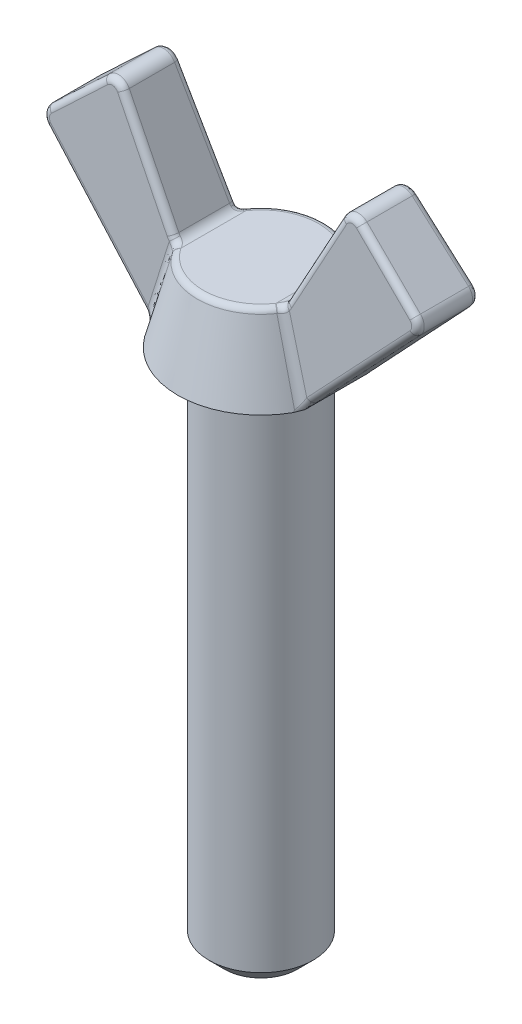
SolidWorks part; units mm, degrees
ref_plane "Front Plane" through (0, 0, 0) normal (0, 0, 1) x (1, 0, 0)
ref_plane "Top Plane" through (0, 0, 0) normal (0, 1, 0) x (1, 0, 0)
ref_plane "Right Plane" through (0, 0, 0) normal (1, 0, 0) x (0, 0, -1)
sketch "HeadSke" plane through (0, 0, 0) normal (0, 0, 1) x (1, 0, 0)
  line L0 (0, 0) -> (-8, 0)
  line L1 (-8, 0) -> (-6, 7.5)
  line L2 (-6, 7.5) -> (0, 7.5)
  line L3 (0, 7.5) -> (0, 0)
  line L4 (0, -38.5148) -> (0, 38.5148) construction
  dimension "Top_Width" = 12
  dimension "Bottom_Width" = 16
  dimension "Head_Height" = 7.5
revolve "Head" add sketch "HeadSke" angle 360 about L4
sketch "BaseWingSke" plane through (0, 0, 0) normal (1, 0, 0) x (0, 0, -1)
  line L0 (0, 0) -> (0, 62.8635) construction
  line L1 (-2.75, 18) -> (-3.25, 0)
  line L2 (-2.75, 18) -> (2.75, 18)
  line L3 (2.75, 18) -> (3.25, 0)
  line L4 (3.25, 0) -> (-3.25, 0)
  point P8 (0, 18)
  dimension "TopWing_Width" = 5.5
  dimension "BottomWing_Width" = 6.5
  dimension "Height" = 18
extrude "BaseWing" add sketch "BaseWingSke" along normal mid plane 36
sketch "CutWingSke" plane through (0, 0, 0) normal (0, 0, 1) x (1, 0, 0)
  line L0 (0, 0) -> (0, 84.5075) construction
  line L1 (-7.3101, 0) -> (-17.6742, 11.0212)
  line L2 (-5.1719, 7.5) -> (-10.4718, 17.3678)
  line L3 (18, 18) -> (-18, 18) construction
  line L4 (-18, 18) -> (-18, 0) construction
  line L5 (-5.1719, 7.5) -> (5.1719, 7.5)
  line L6 (-7.3101, 0) -> (7.3101, 0)
  line L7 (7.3101, 0) -> (17.6742, 11.0212)
  line L8 (5.1719, 7.5) -> (10.4718, 17.3678)
  line L9 (-7.3101, 0) -> (-18, 0) construction
  line L10 (-28, 28) -> (28, 28)
  line L11 (-28, 28) -> (-28, -10)
  line L12 (-28, -10) -> (28, -10)
  line L13 (28, 28) -> (28, -10)
  line L14 (18, 18) -> (18, 0) construction
  line L15 (-12.3511, 17.6742) -> (-17.6221, 12.7174)
  line L16 (12.3511, 17.6742) -> (17.6221, 12.7174)
  arc A0 (-10.4718, 17.3678) -> (-12.3511, 17.6742) centre (-11.529, 16.8) ccw
  arc A1 (-17.6742, 11.0212) -> (-17.6221, 12.7174) centre (-16.8, 11.8433) cw
  arc A2 (12.3511, 17.6742) -> (10.4718, 17.3678) centre (11.529, 16.8) ccw
  arc A3 (17.6742, 11.0212) -> (17.6221, 12.7174) centre (16.8, 11.8433) ccw
  point P27 (-11.2118, 18.7455)
  point P30 (-18.4963, 11.8954)
  point P33 (11.2118, 18.7455)
  point P36 (18.4963, 11.8954)
  dimension "Radius" = 1.2
  dimension "D1" = 10
  dimension "Wing_ang" = 15
  dimension "D2" = 10
  dimension "D3" = 10
  dimension "D4" = 10
extrude "CutWing" cut sketch "CutWingSke" against normal mid plane 36
fillet "Fillet1" radius 1 6 edges at (-5.1719, 7.5, 0) (5.1719, 7.5, 0)
fillet "Fillet2" radius 0.6 38 edges at (-7.5707, 0.2772, 3.2891) (-12.7428, 5.7771, 3.0895) (-8.0054, 12.7756, 2.8951) (-5.2567, 7.7694, 3.1144) (0, 7.5, -6) (0, 7.5, 6) (5.1125, 7.6575, 3.2115) (8.0054, 12.7756, 2.8951) (7.4702, 0.1703, 3.342) (12.7428, 5.7771, 3.0895) (7.5707, 0.2772, -3.2891) (12.7428, 5.7771, -3.0895) (-7.4702, 0.1703, -3.342) (-12.7428, 5.7771, -3.0895) (-8.0054, 12.7756, -2.8951) (-5.1125, 7.6575, -3.2115) (5.2567, 7.7694, -3.1144) (8.0054, 12.7756, -2.8951) (17.9994, 11.8801, -2.92) (14.9866, 15.1958, -2.8279) (11.3359, 17.9844, -2.7504) (-17.9994, 11.8801, -2.92) (-14.9866, 15.1958, -2.8279) (-11.3359, 17.9844, -2.7504) (17.9994, 11.8801, 2.92) (14.9866, 15.1958, 2.8279) (11.3359, 17.9844, 2.7504) (-11.3359, 17.9844, 2.7504) (-14.9866, 15.1958, 2.8279) (-17.9994, 11.8801, 2.92)
sketch "BodySke" plane through (0, 0, 0) normal (0, 0, 1) x (1, 0, 0)
  line L0 (0, 0) -> (0, -98.4281) construction
  line L1 (-4.172, -22.6535) -> (-4.172, -78.0459) construction
  line L2 (0, 0) -> (-5, 0)
  line L3 (0, 0) -> (0, -50)
  line L4 (0, -50) -> (-5, -50)
  line L5 (-5, 0) -> (-5, -50)
  line L6 (9.5285, -49.25) -> (-28.2347, -49.25) construction
  dimension "Diameter" = 10
  dimension "Length" = 50
  dimension "Minor_dia" = 8.344
  dimension "Advance" = 1.5
revolve "BaseBody" add sketch "BodySke" angle 360 about L0
sketch "ChamferedEndSke" plane through (0, 0, 0) normal (0, 0, 1) x (1, 0, 0)
  line L0 (-5, -48.5) -> (-5, -50)
  line L1 (-5, -50) -> (-3.5, -50)
  line L2 (-3.5, -50) -> (-5, -48.5)
  line L5 (0, 0) -> (0, -116.5105) construction
  dimension "Ang" = 45
  dimension "Chamfer_width" = 1.5
revolve "ChamferedEnd" cut sketch "ChamferedEndSke" angle 360 about L5
sketch "CutEndSke" plane through (0, -50, 0) normal (0, -1, 0) x (1, 0, 0)
  circle A0 centre (0, 0) radius 5 construction
  circle A1 centre (0, 0) radius 5
extrude "CutEnd" [suppressed] cut sketch "CutEndSke" against normal blind 1.5
dome "RoundedEnd" [suppressed] faces to dome 1 distance 1.5 parameters "D1"=1.5
sketch "ThdSchSke" plane through (0, 0, 0) normal (0, 0, 1) x (1, 0, 0)
  line L0 (0, 0) -> (0, -154.0819) construction
  line L1 (49.4883, -50) -> (-82.1477, -50) construction
  line L2 (5.9561, -48.247) -> (5, -48.247)
  line L3 (5, -48.247) -> (4.172, -48.725)
  line L4 (4.172, -48.725) -> (5, -49.203)
  line L5 (5, -49.203) -> (5.9561, -49.203)
  line L6 (5.9561, -49.203) -> (5.9561, -48.247)
  dimension "D1" = 8.344
  dimension "Length" = 50
  dimension "D2" = 10
  dimension "D3" = 1.275
revolve "ThreadSchematic" [suppressed] cut sketch "ThdSchSke" angle 360 about L0
pattern_linear "ThdSchPat" [suppressed] count 32 along (0, -1, 0)
equation "\"D1@CutWing\" = \"Width@BaseWing\""
equation "\"D1@Fillet1\" =\"Top_Width@HeadSke\"/12"
equation "\"D1@Fillet2\" = \"Top_Width@HeadSke\"/20"
equation "\"Thread_minor@ThreadCosmetic\" = \"Minor_dia@BodySke\""
equation "\"D1@CutEnd\" = \"Chamfer_width@ChamferedEndSke\""
equation "\"D1@RoundedEnd\" = \"Chamfer_width@ChamferedEndSke\""
equation "\"Length@ThdSchSke\" = \"Length@BodySke\""
equation "\"D1@ThdSchSke\" = \"Minor_dia@BodySke\""
equation "\"D2@ThdSchSke\" = \"Diameter@BodySke\""
equation "\"D3@ThdSchSke\" = \"Advance@BodySke\"*0.85"
equation "\"Advance@ThdSchPat\" = \"Advance@BodySke\""
equation "\"D1@ThdSchPat\" =  int( \"Length@BodySke\" / \"Advance@BodySke\" ) -1"
equation "\"Radius@CutWingSke\" = \"Height@BaseWingSke\"/15"
